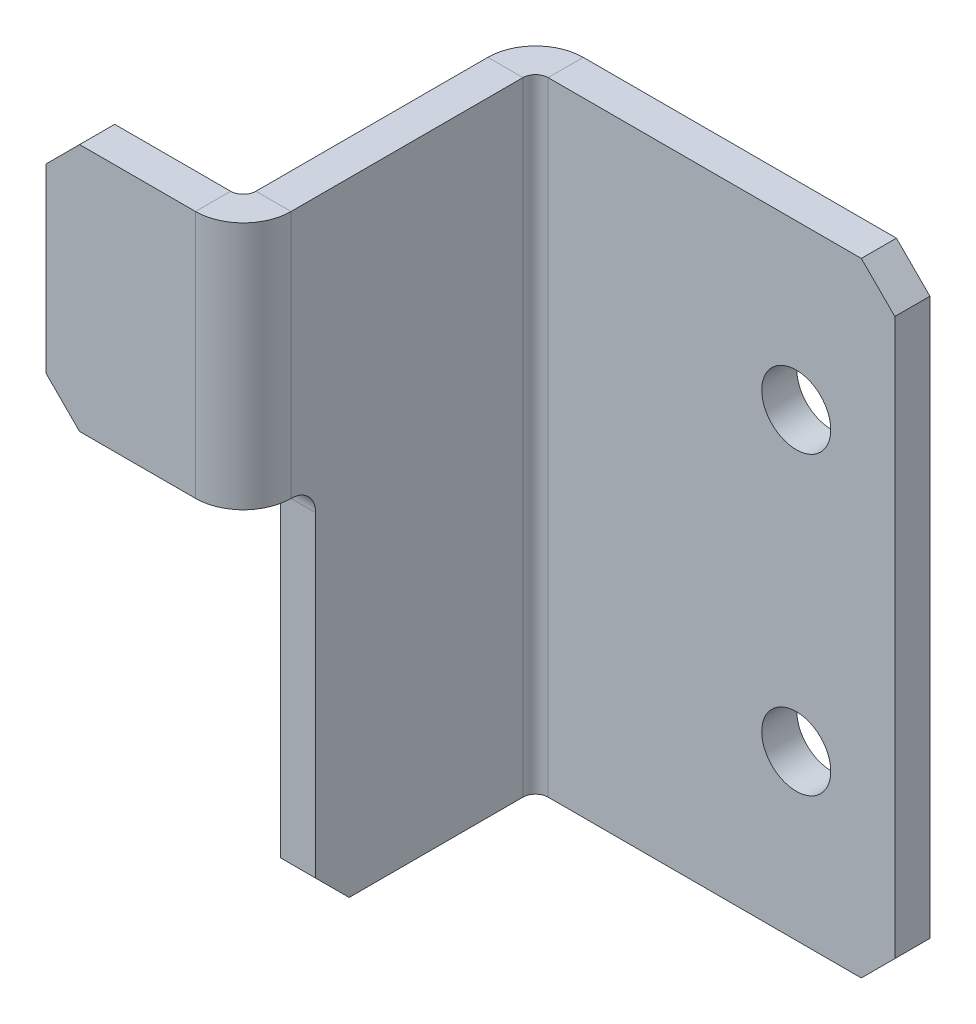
SolidWorks part; units mm, degrees
other "<108-5044-003 Rev1>-<Break-Corner1>" parameters "Thickness"=2.2352
ref_plane "Front Plane" through (0, 0, 0) normal (0, 0, 1) x (1, 0, 0)
ref_plane "Top Plane" through (0, 0, 0) normal (0, 1, 0) x (1, 0, 0)
ref_plane "Right Plane" through (0, 0, 0) normal (1, 0, 0) x (0, 0, -1)
mirrored part "108-5044-003 Rev1_Mirrored"
